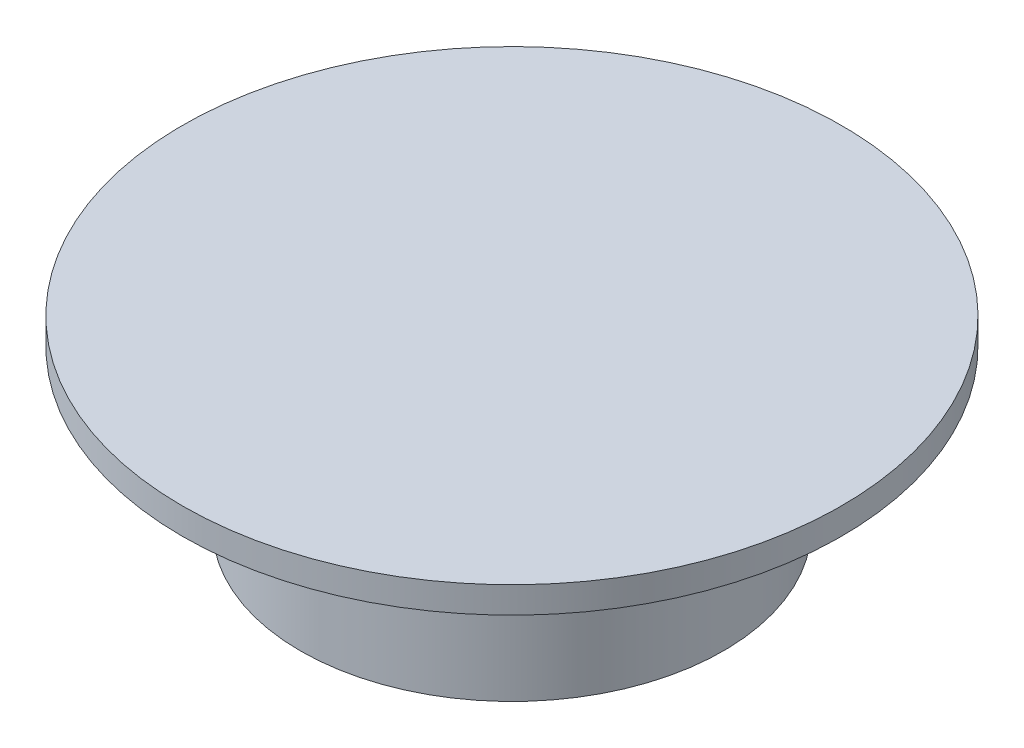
SolidWorks part; units mm, degrees
ref_plane "Front Plane" through (0, 0, 0) normal (0, 0, 1) x (1, 0, 0)
ref_plane "Top Plane" through (0, 0, 0) normal (0, 1, 0) x (1, 0, 0)
ref_plane "Right Plane" through (0, 0, 0) normal (1, 0, 0) x (0, 0, -1)
sketch "Sketch1" plane through (0, 0, 0) normal (0, 0, 1) x (1, 0, 0)
  line L0 (0, 7) -> (0, -7)
  line L1 (0, 7) -> (25, 7)
  line L2 (25, 7) -> (25, 5)
  line L3 (25, 5) -> (16.05, 2)
  line L4 (16.05, 2) -> (16.05, -7)
  line L5 (16.05, -7) -> (0, -7)
  dimension "D1" = 14
  dimension "D2" = 25
  dimension "D3" = 16.05
  dimension "D4" = 9
  dimension "D5" = 2
revolve "Revolve1" add sketch "Sketch1" angle 360 about L0
